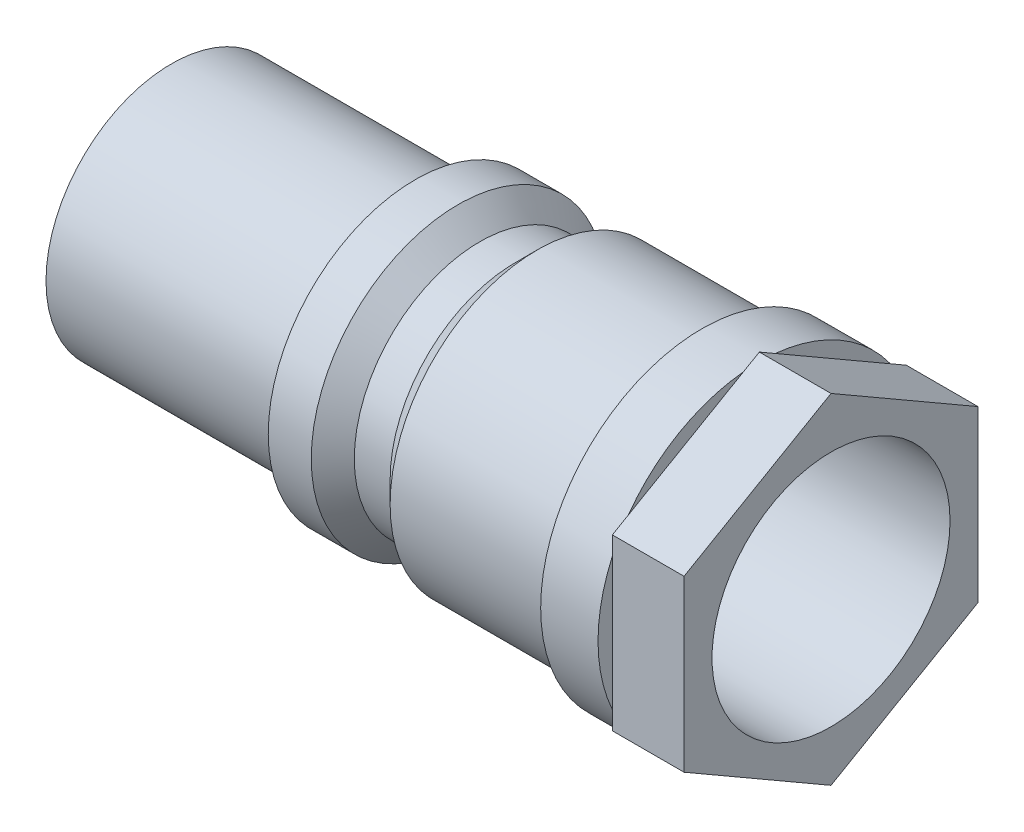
SolidWorks part; units mm, degrees
ref_plane "Alzado" through (0, 0, 0) normal (0, 0, 1) x (1, 0, 0)
ref_plane "Planta" through (0, 0, 0) normal (0, 1, 0) x (1, 0, 0)
ref_plane "Vista lateral" through (0, 0, 0) normal (1, 0, 0) x (0, 0, -1)
sketch "Croquis1" plane through (0, 0, 0) normal (0, 0, 1) x (1, 0, 0)
  line L0 (0, 0) -> (82, 0) construction
  line L1 (0, 0) -> (0, 17.5)
  line L2 (0, 17.5) -> (34, 17.5)
  line L3 (34, 17.5) -> (34, 20.5)
  line L4 (34, 20.5) -> (40, 20.5)
  line L5 (40, 20.5) -> (43, 17.5)
  line L6 (43, 17.5) -> (48, 17.5)
  line L7 (48, 17.5) -> (51, 20.5)
  line L8 (51, 20.5) -> (74, 20.5)
  line L9 (74, 20.5) -> (74, 22.5)
  line L10 (74, 22.5) -> (82, 22.5)
  line L11 (82, 22.5) -> (82, 0)
  line L12 (0, 0) -> (82, 0)
  dimension "D1" = 35
  dimension "D2" = 82
  dimension "D3" = 8
  dimension "D4" = 2
  dimension "D5" = 34
  dimension "D6" = 6
  dimension "D7" = 3
  dimension "D8" = 5
  dimension "D9" = 225
revolve "Revolución1" add sketch "Croquis1" angle 360 about L0
sketch "Croquis2" plane through (82, 0, 0) normal (1, 0, 0) x (0, 0, -1)
  line L1 (0, 23.6714) -> (-20.5, 11.8357)
  line L2 (-20.5, 11.8357) -> (-20.5, -11.8357)
  line L3 (-20.5, -11.8357) -> (0, -23.6714)
  line L4 (0, -23.6714) -> (20.5, -11.8357)
  line L5 (20.5, -11.8357) -> (20.5, 11.8357)
  line L6 (20.5, 11.8357) -> (0, 23.6714)
  circle A0 centre (0, 0) radius 20.5 construction
  dimension "D1" = 41
extrude "Saliente-Extruir1" add sketch "Croquis2" along normal blind 10
sketch "Croquis3" plane through (92, 0, 0) normal (1, 0, 0) x (0, 0, -1)
  circle A0 centre (0, 0) radius 16.6
  dimension "D1" = 33.2
extrude "Cortar-Extruir1" cut sketch "Croquis3" against normal through all
